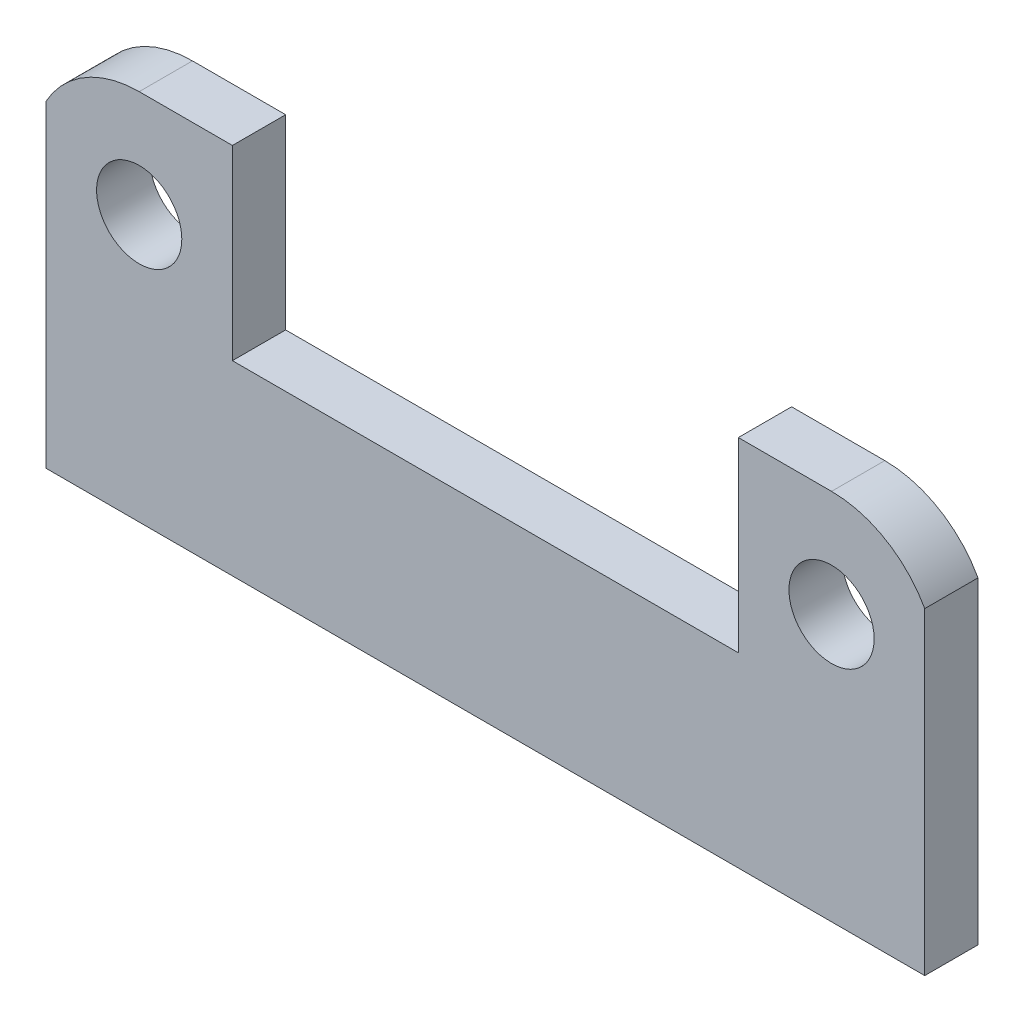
SolidWorks part; units mm, degrees
ref_plane "Спереди" through (0, 0, 0) normal (0, 0, 1) x (1, 0, 0)
ref_plane "Сверху" through (0, 0, 0) normal (0, 1, 0) x (1, 0, 0)
ref_plane "Справа" through (0, 0, 0) normal (1, 0, 0) x (0, 0, -1)
other "Configuration Table"
sketch "Эскиз1" plane through (0, 0, 0) normal (0, 0, 1) x (1, 0, 0)
  line L0 (-7.0687, 18.7411) -> (30.7314, 18.7411) construction
  line L1 (-4.3161, 15.7411) -> (28.6839, 15.7411)
  line L2 (-4.3161, 15.7411) -> (-4.3161, 8.7411)
  line L3 (-4.3161, 8.7411) -> (28.6839, 8.7411)
  line L4 (28.6839, 15.7411) -> (28.6839, 8.7411)
  line L5 (-4.3161, 15.7411) -> (2.6839, 15.7411)
  line L6 (-4.3161, 15.7411) -> (-4.3161, 22.7411)
  line L7 (-4.3161, 22.7411) -> (2.6839, 22.7411)
  line L8 (2.6839, 15.7411) -> (2.6839, 22.7411)
  line L9 (28.6839, 15.7411) -> (21.6839, 15.7411)
  line L10 (28.6839, 15.7411) -> (28.6839, 22.7411)
  line L11 (28.6839, 22.7411) -> (21.6839, 22.7411)
  line L12 (21.6839, 15.7411) -> (21.6839, 22.7411)
  line L13 (-0.8161, 22.7411) -> (-0.8161, 3.2211) construction
  line L14 (25.1839, 22.7411) -> (25.1839, 3.267) construction
  circle A0 centre (-0.8161, 18.7411) radius 1.6
  circle A1 centre (25.1839, 18.7411) radius 1.6
  circle A2 centre (-0.8161, 18.7411) radius 4
  circle A3 centre (25.1839, 18.7411) radius 4
  dimension "D6" = 3.2
  dimension "D7" = 3.2
  dimension "D1" = 33
  dimension "D2" = 7
  dimension "D3" = 7
  dimension "D4" = 7
  dimension "D5" = 4
  dimension "D8" = 7
extrude "Бобышка-Вытянуть1" add sketch "Эскиз1" along normal blind 2 contours L8 A2 L6 L5 A0 | A2 L1 L8 | A2 L6 L1 | A3 L1 A2 L2 L3 L4 | A3 L12 L1 | L10 A3 L12 L9 A1 | L9 A3 | A3 L1 L10 | L5 A2 | A2 L8 L7 | A3 L11 L12
